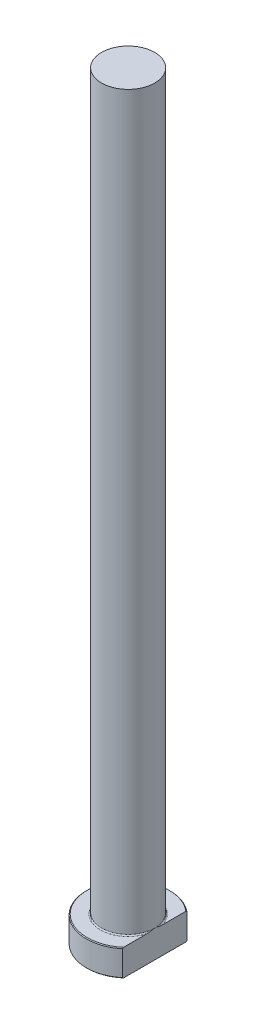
SolidWorks part; units mm, degrees
ref_plane "Front Plane" through (0, 0, 0) normal (0, 0, 1) x (1, 0, 0)
ref_plane "Top Plane" through (0, 0, 0) normal (0, 1, 0) x (1, 0, 0)
ref_plane "Right Plane" through (0, 0, 0) normal (1, 0, 0) x (0, 0, -1)
sketch "Sketch1" plane through (0, 0, 0) normal (0, 0, 1) x (1, 0, 0)
  line L0 (0, 259.9588) -> (0, -15.1925) construction
  line L1 (0, 0) -> (-11, 0)
  line L2 (-11, 0) -> (-11, 7)
  line L3 (-11, 7) -> (-7, 7)
  line L4 (-7, 7) -> (-7, 200)
  line L5 (-7, 200) -> (0, 200)
  line L6 (0, 200) -> (0, 0)
  dimension "L" = 200
  dimension "H" = 22
  dimension "T" = 7
  dimension "D" = 14
revolve "Revolve1" add sketch "Sketch1" angle 360 about L0
chamfer "Chamfer1" distance 0.2 angle 45 2 edges at (0, 7, 11) (0, 0, 11)
fillet "Fillet1" radius 0.3 1 edges at (0, 7, 7)
sketch "Sketch2" plane through (0, 0, 0) normal (0, 1, 0) x (1, 0, 0)
  line L0 (7, 8.4853) -> (7, -8.4853)
  circle A0 centre (0, 0) radius 11 construction
  arc A1 (7, -8.4853) -> (7, 8.4853) centre (0, 0) ccw
  circle A2 centre (0, 0) radius 7 construction
extrude "KEY" cut sketch "Sketch2" along normal through all
